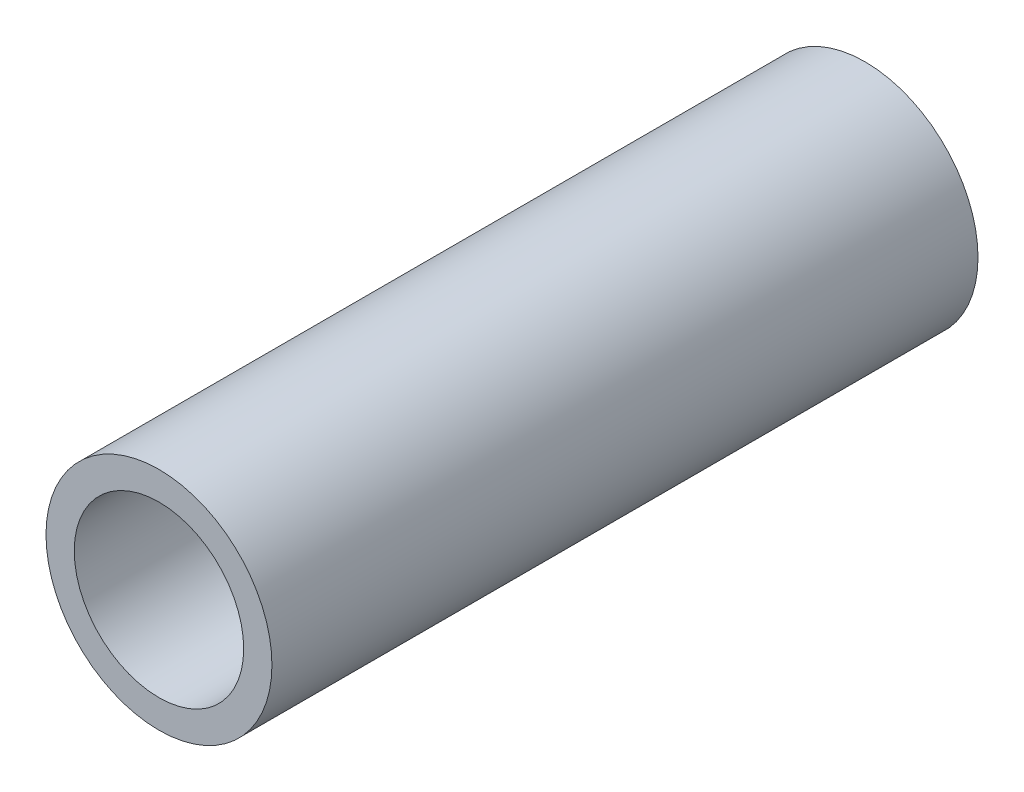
SolidWorks part; units mm, degrees
ref_plane "Plan de face" through (0, 0, 0) normal (0, 0, 1) x (1, 0, 0)
ref_plane "Plan de dessus" through (0, 0, 0) normal (0, 1, 0) x (1, 0, 0)
ref_plane "Plan de droite" through (0, 0, 0) normal (1, 0, 0) x (0, 0, -1)
sketch "Esquisse1" plane through (0, 0, 0) normal (0, 0, 1) x (1, 0, 0)
  circle A0 centre (0, 0) radius 8
  circle A1 centre (0, 0) radius 6
  dimension "D1" = 16
  dimension "D2" = 12
extrude "Boss.-Extru.1" add sketch "Esquisse1" along normal blind 50
